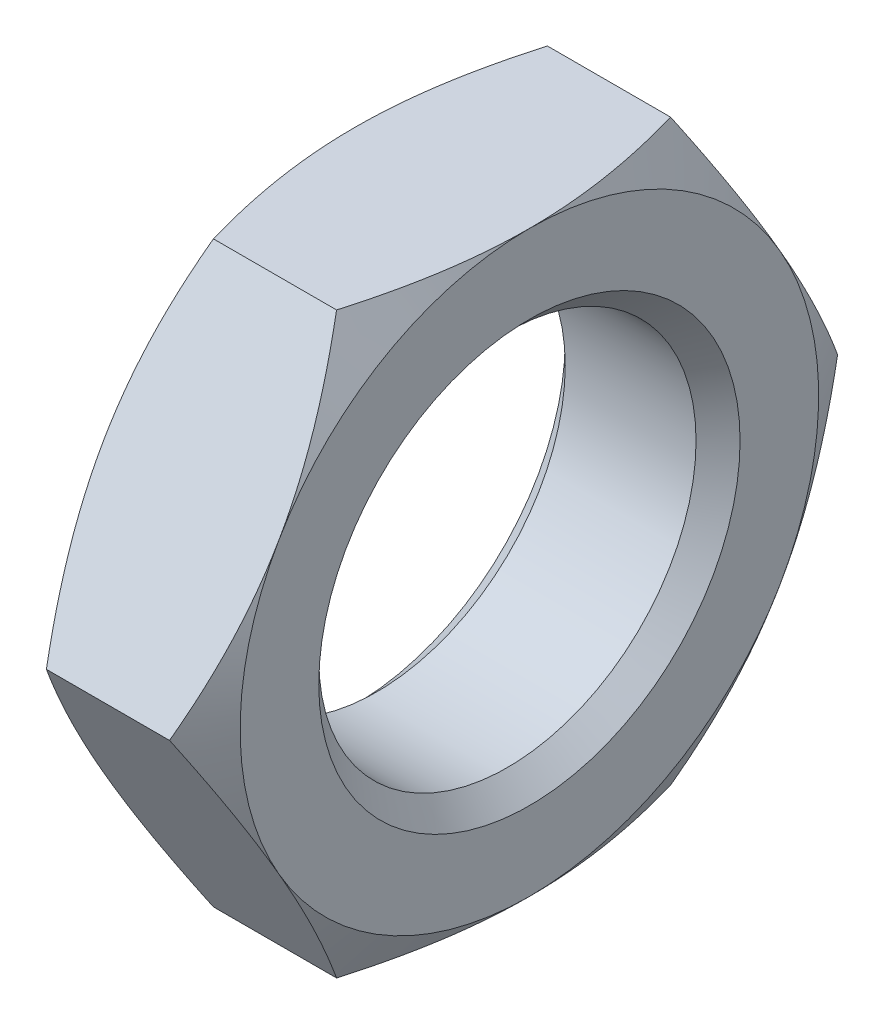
SolidWorks part; units mm, degrees
ref_plane "Front Plane" through (0, 0, 0) normal (0, 0, 1) x (1, 0, 0)
ref_plane "Top Plane" through (0, 0, 0) normal (0, 1, 0) x (1, 0, 0)
ref_plane "Right Plane" through (0, 0, 0) normal (1, 0, 0) x (0, 0, -1)
sketch "Sketch1" plane through (0, 0, 0) normal (1, 0, 0) x (0, 0, -1)
  line L1 (13.2791, 23) -> (-13.2791, 23)
  line L2 (-13.2791, 23) -> (-26.5581, 0)
  line L3 (-26.5581, 0) -> (-13.2791, -23)
  line L4 (-13.2791, -23) -> (13.2791, -23)
  line L5 (13.2791, -23) -> (26.5581, 0)
  line L6 (26.5581, 0) -> (13.2791, 23)
  circle A0 centre (0, 0) radius 23 construction
  circle A1 centre (0, 0) radius 15
extrude "Extrude1" add sketch "Sketch1" along normal blind 13.9
sketch "Sketch2" plane through (0, 0, 0) normal (0, 0, 1) x (1, 0, 0)
  line L0 (13.9, 23) -> (13.9, 92)
  line L1 (13.9, 92) -> (0, 92)
  line L2 (0, 92) -> (0, 23)
  line L3 (0, 23) -> (6.95, 35.0378)
  line L4 (6.95, 35.0378) -> (13.9, 23)
revolve "Cut-Revolve1" cut sketch "Sketch2" angle 360 about axis through (13.9, 0, 0) along (-1, 0, 0)
chamfer "Chamfer1" distance 1.75 angle 45 2 edges at (0, 0, -15) (13.9, 0, -15)
equation "\"D2@Sketch2\"=\"D1@Sketch1\"*2"
